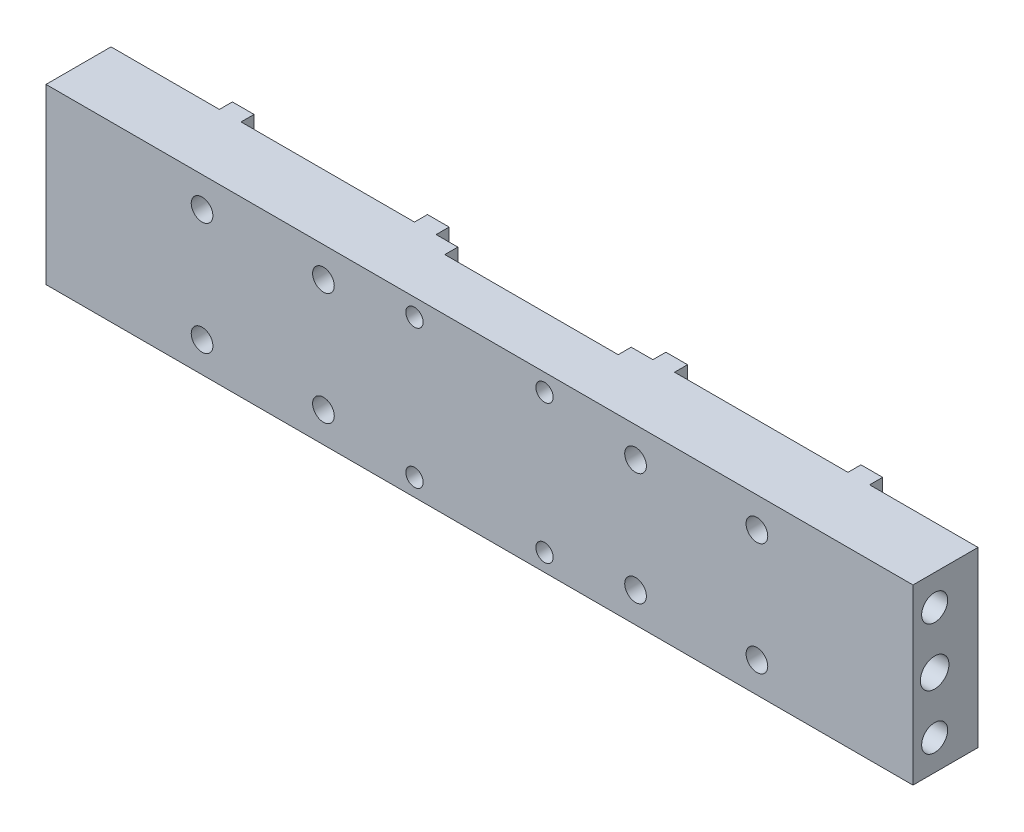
SolidWorks part; units mm, degrees
ref_plane "Plan de face" through (0, 0, 0) normal (0, 0, 1) x (1, 0, 0)
ref_plane "Plan de dessus" through (0, 0, 0) normal (0, 1, 0) x (1, 0, 0)
ref_plane "Plan de droite" through (0, 0, 0) normal (1, 0, 0) x (0, 0, -1)
sketch "Esquisse1" plane through (0, 0, 0) normal (0, 0, 1) x (1, 0, 0)
  line L0 (0, 80.3793) -> (0, -91.4076) construction
  line L1 (-100, -13.6076) -> (100, -13.6076)
  line L2 (-100, -13.6076) -> (-100, -53.6076)
  line L3 (-100, -53.6076) -> (100, -53.6076)
  line L4 (100, -13.6076) -> (100, -53.6076)
  line L5 (-70, -13.6076) -> (-70, -53.6076) construction
  line L6 (70, -13.6076) -> (70, -53.6076) construction
  line L7 (-30, -13.6076) -> (-30, -53.6076) construction
  line L8 (30, -13.6076) -> (30, -53.6076) construction
  line L9 (20, -13.6076) -> (20, -53.6076) construction
  line L10 (-20, -13.6076) -> (-20, -53.6076) construction
  line L11 (-64, -20.6076) -> (-64, -46.6076) construction
  line L12 (-36, -20.6076) -> (-36, -46.6076) construction
  line L13 (36, -20.6076) -> (36, -46.6076) construction
  line L14 (64, -20.6076) -> (64, -46.6076) construction
  line L15 (-72, -13.6076) -> (-72, -53.6076) construction
  line L16 (-40, -13.6076) -> (-40, -53.6076) construction
  line L17 (-72, -33.6076) -> (-87.0016, -33.6076) construction
  line L18 (72, -13.6076) -> (72, -53.6076) construction
  line L19 (40, -13.6076) -> (40, -53.6076) construction
  line L20 (72, -33.6076) -> (86.0513, -33.6076) construction
  line L21 (15, -53.6076) -> (15, -13.6076) construction
  line L22 (-15, -53.6076) -> (-15, -13.6076) construction
  circle A0 centre (-64, -20.6076) radius 2.5
  circle A1 centre (-36, -20.6076) radius 2.5
  circle A2 centre (-64, -46.6076) radius 2.5
  circle A3 centre (-36, -46.6076) radius 2.5
  circle A4 centre (36, -20.6076) radius 2.5
  circle A5 centre (64, -20.6076) radius 2.5
  circle A6 centre (36, -46.6076) radius 2.5
  circle A7 centre (64, -46.6076) radius 2.5
  circle A10 centre (15, -17.6076) radius 2
  circle A11 centre (15, -49.6076) radius 2
  circle A12 centre (-15, -17.6076) radius 2
  circle A13 centre (-15, -49.6076) radius 2
  dimension "D9" = 5
  dimension "D10" = 5
  dimension "D11" = 5
  dimension "D12" = 5
  dimension "D13" = 5
  dimension "D14" = 5
  dimension "D15" = 5
  dimension "D16" = 5
  dimension "D26" = 32
  dimension "D31" = 5
  dimension "D32" = 5
  dimension "D33" = 4
  dimension "D34" = 4
  dimension "D41" = 4
  dimension "D42" = 4
  dimension "D44" = 4
  dimension "D46" = 4
  dimension "D1" = 200
  dimension "D2" = 40
  dimension "D4" = 20
  dimension "D5" = 40
  dimension "D6" = 40
  dimension "D7" = 10
  dimension "D8" = 10
  dimension "D17" = 26
  dimension "D18" = 28
  dimension "D19" = 6
  dimension "D20" = 7
  dimension "D21" = 28
  dimension "D22" = 26
  dimension "D23" = 6
  dimension "D24" = 7
  dimension "D25" = 28
  dimension "D28" = 28
  dimension "D29" = 32
  dimension "D35" = 7
  dimension "D36" = 7
  dimension "D37" = 7
  dimension "D38" = 20
  dimension "D39" = 26
  dimension "D40" = 100
  dimension "D43" = 4
  dimension "D45" = 4
extrude "Extrusion1" add sketch "Esquisse1" along normal blind 12
sketch "Esquisse3" plane through (0, 0, 0) normal (0, 0, -1) x (-1, 0, 0)
  line L0 (100, -53.6076) -> (-100, -53.6076) construction
  line L1 (-100, -13.6076) -> (-20, -13.6076)
  line L2 (-100, -13.6076) -> (-100, -53.6076)
  line L3 (-100, -53.6076) -> (-20, -53.6076)
  line L4 (-20, -13.6076) -> (-20, -53.6076)
  line L5 (0, -13.6076) -> (0, -53.6076) construction
  line L6 (100, -13.6076) -> (20, -13.6076)
  line L7 (100, -13.6076) -> (100, -53.6076)
  line L8 (100, -53.6076) -> (20, -53.6076)
  line L9 (20, -13.6076) -> (20, -53.6076)
  line L10 (-100, -13.6076) -> (100, -13.6076) construction
  circle A0 centre (64, -20.6076) radius 2.5
  circle A1 centre (36, -20.6076) radius 2.5
  circle A2 centre (64, -46.6076) radius 2.5
  circle A3 centre (36, -46.6076) radius 2.5
  circle A4 centre (-36, -20.6076) radius 2.5
  circle A5 centre (-64, -20.6076) radius 2.5
  circle A6 centre (-36, -46.6076) radius 2.5
  circle A7 centre (-64, -46.6076) radius 2.5
  dimension "D1" = 40
  dimension "20" = 20
extrude "Boss.-Extru.1" add sketch "Esquisse3" along normal blind 3
sketch "Esquisse4" plane through (-100, 0, 0) normal (-1, 0, 0) x (0, 0, 1)
  line L0 (12, -53.6076) -> (-3, -53.6076) construction
  line L1 (12, -13.6076) -> (12, -53.6076) construction
  line L2 (12, -13.6076) -> (-3, -13.6076) construction
  circle A0 centre (7, -20.6076) radius 3
  circle A1 centre (7, -46.6076) radius 3
  dimension "D1" = 6
  dimension "D2" = 6
  dimension "D3" = 7
  dimension "D4" = 7
  dimension "D5" = 5
extrude "Enlèv. mat.-Extru.1" cut sketch "Esquisse4" against normal blind 8
sketch "Esquisse5" plane through (100, 0, 0) normal (1, 0, 0) x (0, 0, -1)
  line L0 (-12, -53.6076) -> (3, -53.6076) construction
  line L1 (-12, -53.6076) -> (-12, -13.6076) construction
  line L2 (-12, -13.6076) -> (3, -13.6076) construction
  circle A0 centre (-7, -20.6076) radius 3
  circle A1 centre (-7, -46.6076) radius 3
  dimension "D1" = 6
  dimension "D2" = 6
  dimension "D3" = 7
  dimension "D4" = 7
  dimension "D5" = 5
extrude "Enlèv. mat.-Extru.2" cut sketch "Esquisse5" against normal blind 8
sketch "Esquisse6" plane through (0, 0, -3) normal (0, 0, -1) x (-1, 0, 0)
  line L0 (-30, -13.6076) -> (-30, -53.6076) construction
  line L1 (-20, -13.6076) -> (-100, -13.6076) construction
  line L2 (-100, -53.6076) -> (-20, -53.6076) construction
  line L3 (30, -13.6076) -> (30, -53.6076) construction
  line L4 (100, -13.6076) -> (20, -13.6076) construction
  line L5 (20, -53.6076) -> (100, -53.6076) construction
  line L6 (-70, -13.6076) -> (-70, -53.6076) construction
  line L7 (70, -13.6076) -> (70, -53.6076) construction
  line L8 (-20, -53.6076) -> (-20, -13.6076) construction
  line L10 (20, -13.6076) -> (20, -53.6076) construction
  line L12 (-30, -13.6076) -> (-25, -13.6076)
  line L13 (-30, -13.6076) -> (-30, -53.6076)
  line L14 (-30, -53.6076) -> (-25, -53.6076)
  line L15 (-25, -13.6076) -> (-25, -53.6076)
  line L16 (25, -13.6076) -> (30, -13.6076)
  line L17 (25, -13.6076) -> (25, -53.6076)
  line L18 (25, -53.6076) -> (30, -53.6076)
  line L19 (30, -13.6076) -> (30, -53.6076)
  line L20 (-75, -13.6076) -> (-70, -13.6076)
  line L21 (-75, -13.6076) -> (-75, -53.6076)
  line L22 (-75, -53.6076) -> (-70, -53.6076)
  line L23 (-70, -13.6076) -> (-70, -53.6076)
  line L24 (70, -13.6076) -> (75, -13.6076)
  line L25 (70, -13.6076) -> (70, -53.6076)
  line L26 (70, -53.6076) -> (75, -53.6076)
  line L27 (75, -13.6076) -> (75, -53.6076)
  dimension "D1" = 10
  dimension "D2" = 10
  dimension "D3" = 40
  dimension "D4" = 40
  dimension "D5" = 5
  dimension "D6" = 5
  dimension "D7" = 5
  dimension "D8" = 5
extrude "Boss.-Extru.2" add sketch "Esquisse6" along normal blind 3
hole_wizard "Trou taraudé G1/161" positions "Esquisse9" profile "Esquisse8" tap size "G1/16" standard "ISO"
sketch "Esquisse9" plane through (-100, 0, 0) normal (-1, 0, 0) x (0, 0, 1)
  line L0 (12, -53.6076) -> (-3, -53.6076) construction
  line L1 (12, -13.6076) -> (12, -53.6076) construction
  point P0 (7, -33.6076)
  dimension "D1" = 20
  dimension "D2" = 5
sketch "Esquisse8" plane through (-100, -33.6076, 7) normal (0, 1, 0) x (0, 0, 1)
  line L0 (0, 0) -> (0, 14.7028)
  line L1 (0, 14.7028) -> (3.3, 12.72)
  line L2 (3.3, 12.72) -> (3.3, 0)
  line L5 (3.3, 0) -> (0, 0)
  line L10 (0, 14.7028) -> (-3.3, 12.72) construction
  line L11 (0, -6.35) -> (0, 107.95) construction
  dimension "Diamètre du trou pour taraudage" = 6.6
  dimension "Profondeur du trou pour taraudage" = 12.72
  dimension "Angle de pointe" = 118
hole_wizard "Trou taraudé G1/162" positions "Esquisse11" profile "Esquisse10" tap size "G1/16" standard "ISO"
sketch "Esquisse11" plane through (100, 0, 0) normal (1, 0, 0) x (0, 0, -1)
  line L0 (-12, -53.6076) -> (3, -53.6076) construction
  line L1 (-12, -53.6076) -> (-12, -13.6076) construction
  point P0 (-7, -33.6076)
  dimension "D1" = 20
  dimension "D2" = 5
sketch "Esquisse10" plane through (100, -33.6076, 7) normal (0, 1, 0) x (0, 0, -1)
  line L0 (0, 0) -> (0, 14.7028)
  line L1 (0, 14.7028) -> (3.3, 12.72)
  line L2 (3.3, 12.72) -> (3.3, 0)
  line L5 (3.3, 0) -> (0, 0)
  line L10 (0, 14.7028) -> (-3.3, 12.72) construction
  line L11 (0, -6.35) -> (0, 107.95) construction
  dimension "Diamètre du trou pour taraudage" = 6.6
  dimension "Profondeur du trou pour taraudage" = 12.72
  dimension "Angle de pointe" = 118
